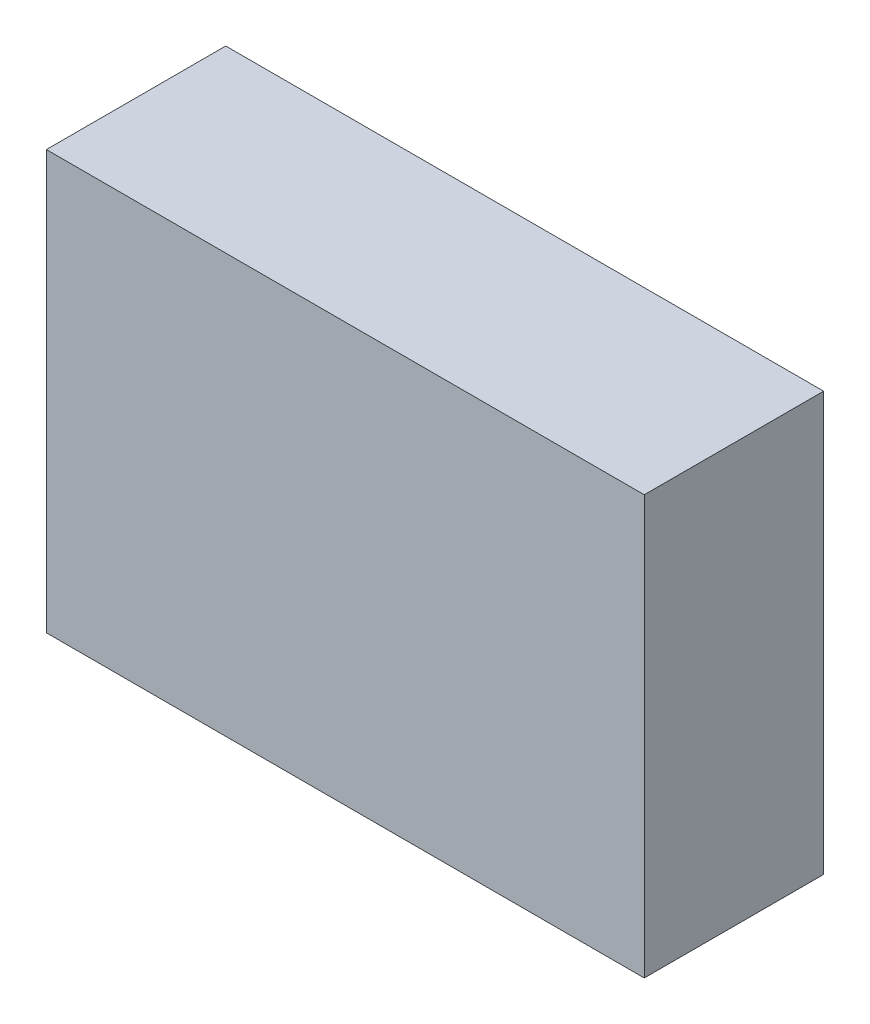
SolidWorks part; units mm, degrees
ref_plane "Front Plane" through (0, 0, 0) normal (0, 0, 1) x (1, 0, 0)
ref_plane "Top Plane" through (0, 0, 0) normal (0, 1, 0) x (1, 0, 0)
ref_plane "Right Plane" through (0, 0, 0) normal (1, 0, 0) x (0, 0, -1)
sketch "Sketch1" plane through (0, 0, 0) normal (0, 1, 0) x (1, 0, 0)
  line L1 (-5, -1.5) -> (5, -1.5)
  line L2 (-5, -1.5) -> (-5, 1.5)
  line L3 (-5, 1.5) -> (5, 1.5)
  line L4 (5, -1.5) -> (5, 1.5)
  line L5 (-5, -1.5) -> (5, 1.5) construction
  line L6 (-5, 1.5) -> (5, -1.5) construction
  point P0 (0, 0)
  dimension "D1" = 10
  dimension "D2" = 3
extrude "Boss-Extrude1" add sketch "Sketch1" along normal blind 7
